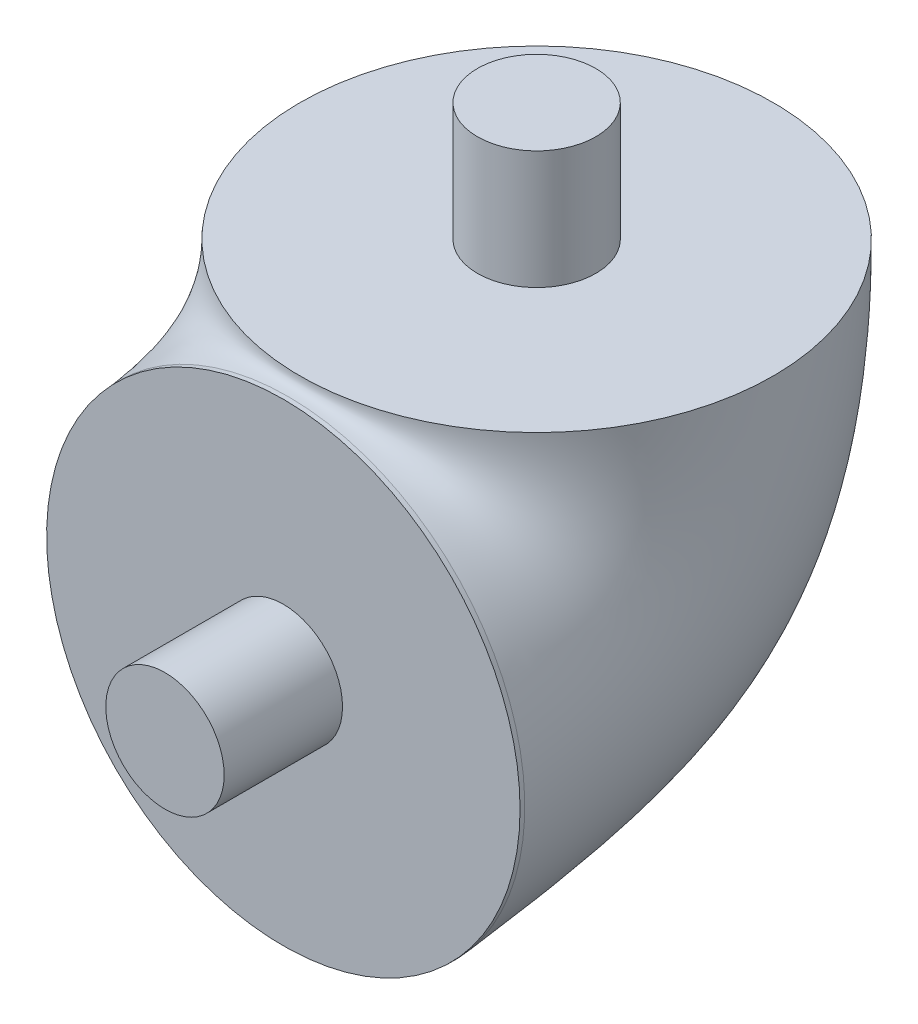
SolidWorks part; units mm, degrees
ref_plane "Ebene vorne" through (0, 0, 0) normal (0, 0, 1) x (1, 0, 0)
ref_plane "Ebene oben" through (0, 0, 0) normal (0, 1, 0) x (1, 0, 0)
ref_plane "Ebene rechts" through (0, 0, 0) normal (1, 0, 0) x (0, 0, -1)
sketch "Skizze1" plane through (0, 0, 0) normal (0, 0, 1) x (1, 0, 0)
  circle A0 centre (0, 0) radius 100
  dimension "D1" = 200
extrude "Aufsatz-Linear austragen1" add sketch "Skizze1" along normal blind 2
sketch "Skizze2" plane through (0, 0, 2) normal (0, 0, 1) x (1, 0, 0)
  circle A0 centre (0, 0) radius 25
  dimension "D1" = 50
extrude "Aufsatz-Linear austragen2" add sketch "Skizze2" along normal blind 50
ref_plane "Ebene1" through (0, 105, 0) normal (0, 1, 0) x (1, 0, 0)
sketch "Skizze4" plane through (0, 105, 0) normal (0, 1, 0) x (1, 0, 0)
  circle A0 centre (0, 105) radius 100
  dimension "D1" = 200
  dimension "D2" = 105
other "Begrenzung1"
sketch "Skizze5" plane through (0, 105, 0) normal (0, 1, 0) x (1, 0, 0)
  circle A1 centre (0, 105) radius 100 construction
  circle A2 centre (0, 105) radius 98
  circle A3 centre (0, 105) radius 98
  circle A4 centre (0, 105) radius 100
  dimension "D1" = 2
sketch "Skizze6" plane through (0, 105, 0) normal (0, 1, 0) x (1, 0, 0)
  circle A0 centre (0, 105) radius 25
  dimension "D1" = 50
extrude "Aufsatz-Linear austragen3" add sketch "Skizze6" along normal blind 50
